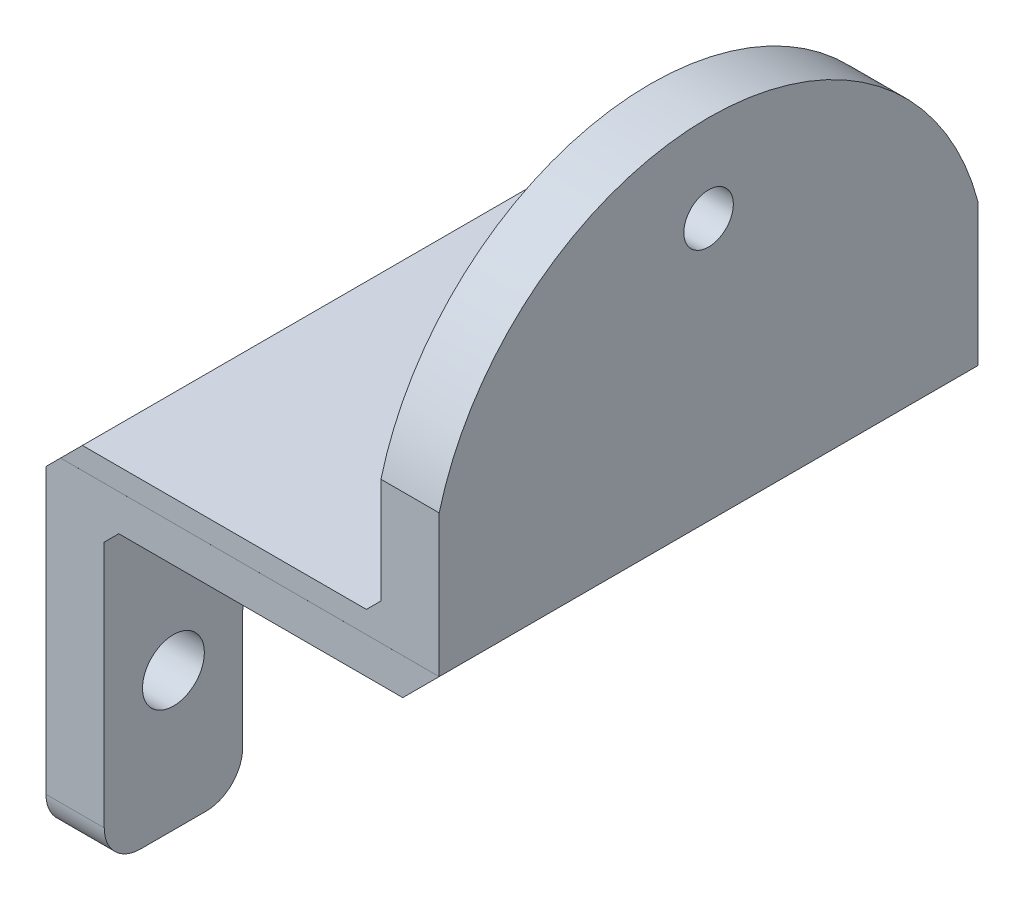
SolidWorks part; units mm, degrees
ref_plane "Plan de face" through (0, 0, 0) normal (0, 0, 1) x (1, 0, 0)
ref_plane "Plan de dessus" through (0, 0, 0) normal (0, 1, 0) x (1, 0, 0)
ref_plane "Plan de droite" through (0, 0, 0) normal (1, 0, 0) x (0, 0, -1)
sketch "Esquisse1" plane through (0, 0, 0) normal (0, 0, 1) x (1, 0, 0)
  line L1 (0, 0) -> (8, 0)
  line L2 (0, 0) -> (0, 49)
  line L4 (8, 0) -> (8, 41)
  line L5 (0, 49) -> (46, 49)
  line L7 (8, 41) -> (54, 41)
  line L10 (54, 41) -> (54, 94)
  line L11 (54, 94) -> (46, 94)
  line L12 (46, 49) -> (46, 94)
  dimension "D1" = 8
  dimension "D2" = 8
  dimension "D3" = 8
  dimension "D4" = 49
  dimension "D5" = 45
  dimension "D6" = 46
extrude "Boss.-Extru.1" add sketch "Esquisse1" along normal mid plane 74
sketch "Esquisse2" plane through (8, 0, 0) normal (1, 0, 0) x (0, 0, -1)
  line L0 (-37, 41) -> (37, 41) construction
  line L1 (-37, 0) -> (37, 0) construction
  line L2 (18, 21) -> (18, 0)
  line L3 (-18, 21) -> (-18, 0)
  line L4 (-18, 0) -> (18, 0)
  arc A0 (18, 21) -> (-18, 21) centre (0, 21) ccw
  circle A1 centre (27.5, 19) radius 4.25
  circle A2 centre (-27.5, 19) radius 4.25
  dimension "D1" = 8.5
  dimension "D2" = 36
  dimension "D3" = 2
  dimension "D4" = 19
  dimension "D5" = 55
  dimension "D6" = 27.5
extrude "Enlèv. mat.-Extru.1" cut sketch "Esquisse2" against normal blind 30
fillet "Congé1" radius 5 4 edges at (4, 0, 37) (4, 0, 18) (4, 0, -18) (4, 0, -37)
hole_wizard "Trou taraudé M81" positions "Esquisse5" profile "Esquisse4" tap size "M8" standard "Iso"
sketch "Esquisse5" plane through (54, 0, 0) normal (1, 0, 0) x (0, 0, -1)
  line L0 (-37, 94) -> (37, 94) construction
  point P0 (0, 82)
  dimension "D1" = 12
sketch "Esquisse4" plane through (54, 82, 0) normal (0, 1, 0) x (0, 0, -1)
  line L0 (0, 0) -> (0, 54)
  line L1 (0, 54) -> (3.4, 54)
  line L2 (3.4, 54) -> (3.4, 0)
  line L5 (3.4, 0) -> (0, 0)
  line L11 (0, -6.35) -> (0, 107.95) construction
  dimension "Diamètre du trou pour taraudage jusqu'au prochain" = 6.8
  dimension "Profondeur du trou pour taraudage jusqu'au prochain" = 54
chamfer "Chanfrein1" distance 5 angle 45 2 edges at (54, 41, 0) (0, 49, 0)
chamfer "Chanfrein2" distance 2 angle 45 2 edges at (8, 41, 0) (46, 49, 0)
sketch "Esquisse6" plane through (54, 0, 0) normal (1, 0, 0) x (0, 0, -1)
  line L0 (-37, 94) -> (37, 94) construction
  line L1 (-37, 46) -> (37, 46) construction
  line L2 (-37, 46) -> (-36.9995, 46)
  line L3 (36.9995, 46) -> (37, 46)
  arc A0 (36.9995, 46) -> (-36.9995, 46) centre (0, 55.74) ccw
  dimension "D1" = 55.74
extrude "Enlèv. mat.-Extru.3" cut sketch "Esquisse6" against normal through all
